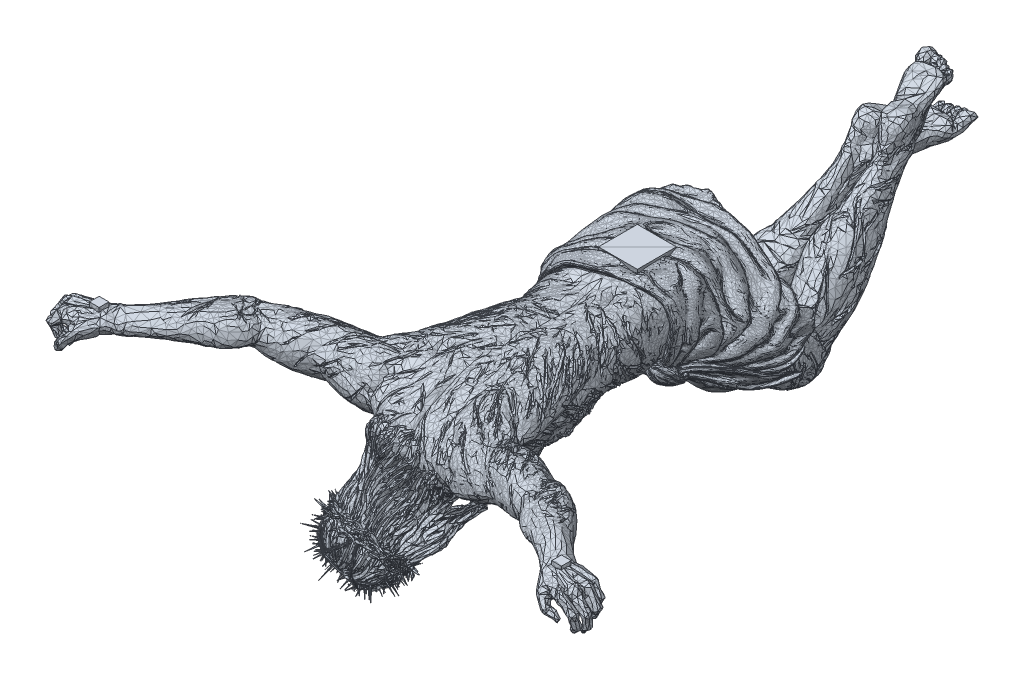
SolidWorks part; units mm, degrees
ref_plane "Front Plane" through (0, 0, 0) normal (1, 0, 0) x (0, 1, 0)
ref_plane "Top Plane" through (0, 0, 0) normal (0, 0, 1) x (0, 1, 0)
ref_plane "Right Plane" through (0, 0, 0) normal (0, 1, 0) x (-1, 0, 0)
imported_body "Imported1"
imported_body "Imported2"
imported_body "Imported3"
sketch "Sketch2" plane through (0, -177.2888, 0) normal (0, 1, 0) x (-1, 0, 0)
  line L1 (-676.6012, 3996.2004) -> (-646.9128, 3996.2004)
  line L2 (-676.6012, 3996.2004) -> (-676.6012, 3963.3526)
  line L3 (-676.6012, 3963.3526) -> (-646.9128, 3963.3526)
  line L4 (-646.9128, 3996.2004) -> (-646.9128, 3963.3526)
  line L5 (498.6643, 3993.8502) -> (517.6161, 3993.8502)
  line L6 (498.6643, 3993.8502) -> (498.6643, 3980.2406)
  line L7 (498.6643, 3980.2406) -> (517.6161, 3980.2406)
  line L8 (517.6161, 3993.8502) -> (517.6161, 3980.2406)
extrude "Cut-Extrude2" cut sketch "Sketch2" along normal through all
sketch "Sketch3" plane through (46.7781, -744.5124, 177.3971) normal (-0.061, 0.971, -0.2314) x (-0.9981, -0.0593, 0.0141)
  line L1 (-71.5745, 2486.9676) -> (7.1354, 2486.9676)
  line L2 (-71.5745, 2486.9676) -> (-71.5745, 2399.3636)
  line L3 (-71.5745, 2399.3636) -> (7.1354, 2399.3636)
  line L4 (7.1354, 2486.9676) -> (7.1354, 2399.3636)
extrude "Cut-Extrude3" cut sketch "Sketch3" along normal through all contours L2 L3 L4 L1
